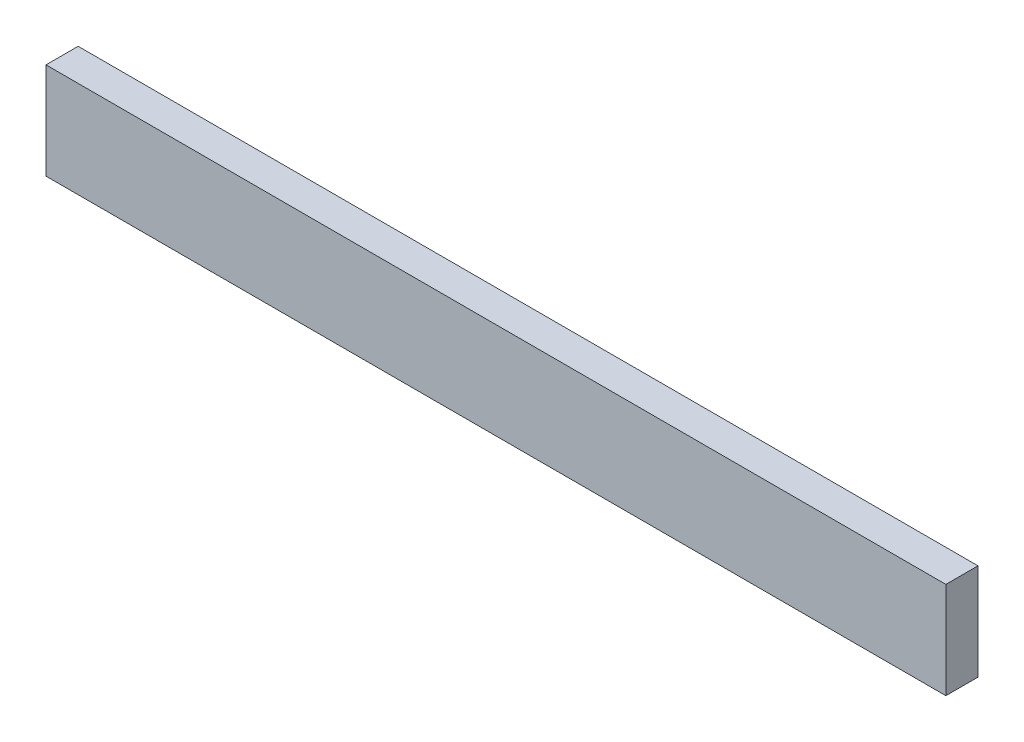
SolidWorks part; units mm, degrees
ref_plane "Front Plane" through (0, 0, 0) normal (0, 0, 1) x (1, 0, 0)
ref_plane "Top Plane" through (0, 0, 0) normal (0, 1, 0) x (1, 0, 0)
ref_plane "Right Plane" through (0, 0, 0) normal (1, 0, 0) x (0, 0, -1)
sketch "Sketch1" plane through (0, 0, 0) normal (0, 1, 0) x (1, 0, 0)
  line L0 (0, 0) -> (-304.8, 0)
  line L1 (0, 0) -> (0, 12.7)
  line L2 (-304.8, 0) -> (-304.8, 12.7)
  line L3 (-304.8, 12.7) -> (0, 12.7)
  line L4 (-304.8, 0) -> (-355.6, 0)
  line L5 (-355.6, 0) -> (-355.6, 12.7)
  line L6 (-355.6, 12.7) -> (-304.8, 12.7)
  dimension "D1" = 12.7
  dimension "D2" = 12.7
extrude "Boss-Extrude1" add sketch "Sketch1" along normal blind 38.1 contours L6 L5 L4 L2 | L3 L2 L0 L1
sketch "Sketch2" plane through (0, 0, 0) normal (0, 0, 1) x (1, 0, 0)
  line L0 (-355.6, 31.75) -> (-355.6, 6.35)
  line L1 (-355.6, 38.1) -> (-355.6, 0) construction
  line L2 (0, 0) -> (-177.8, 0)
  line L3 (0, 0) -> (-355.6, 0) construction
  line L4 (-177.8, 0) -> (-355.6, 6.35)
  line L5 (-355.6, 19.05) -> (0, 19.05)
  line L6 (0, 38.1) -> (0, 0) construction
  line L7 (-177.8, 38.1) -> (-355.6, 31.75)
